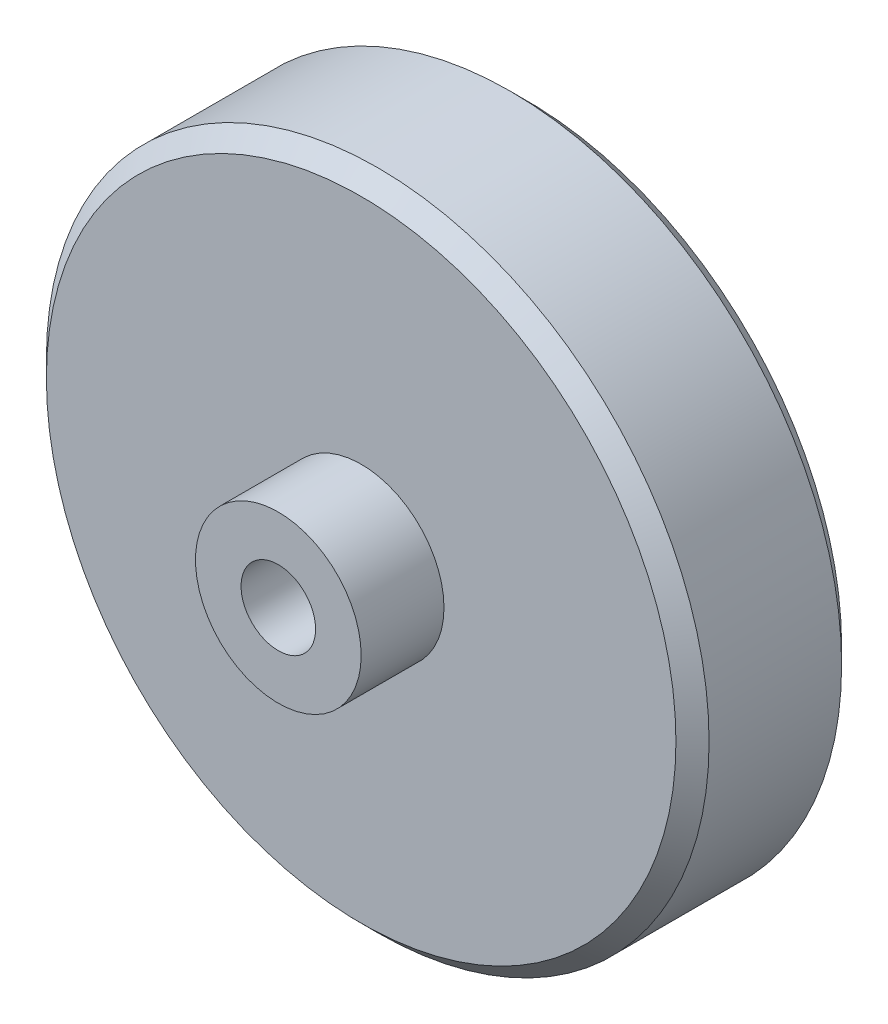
SolidWorks part; units mm, degrees
ref_plane "Front Plane" through (0, 0, 0) normal (0, 0, 1) x (1, 0, 0)
ref_plane "Top Plane" through (0, 0, 0) normal (0, 1, 0) x (1, 0, 0)
ref_plane "Right Plane" through (0, 0, 0) normal (1, 0, 0) x (0, 0, -1)
sketch "Sketch1" plane through (0, 0, 0) normal (0, 0, 1) x (1, 0, 0)
  circle A0 centre (0, 0) radius 20
  dimension "D1" = 40
extrude "Extrude1" add sketch "Sketch1" along normal blind 10
sketch "Sketch2" plane through (0, 0, 10) normal (0, 0, 1) x (1, 0, 0)
  circle A0 centre (0, 0) radius 5
  dimension "D1" = 10
extrude "Extrude2" add sketch "Sketch2" along normal blind 5
sketch "Sketch3" plane through (0, 0, 15) normal (0, 0, 1) x (1, 0, 0)
  circle A0 centre (0, 0) radius 2.25
  dimension "D1" = 4.5
extrude "Extrude3" cut sketch "Sketch3" against normal through all
chamfer "Chamfer1" distance 1 angle 45 2 edges at (20, 0, 0) (20, 0, 10)
